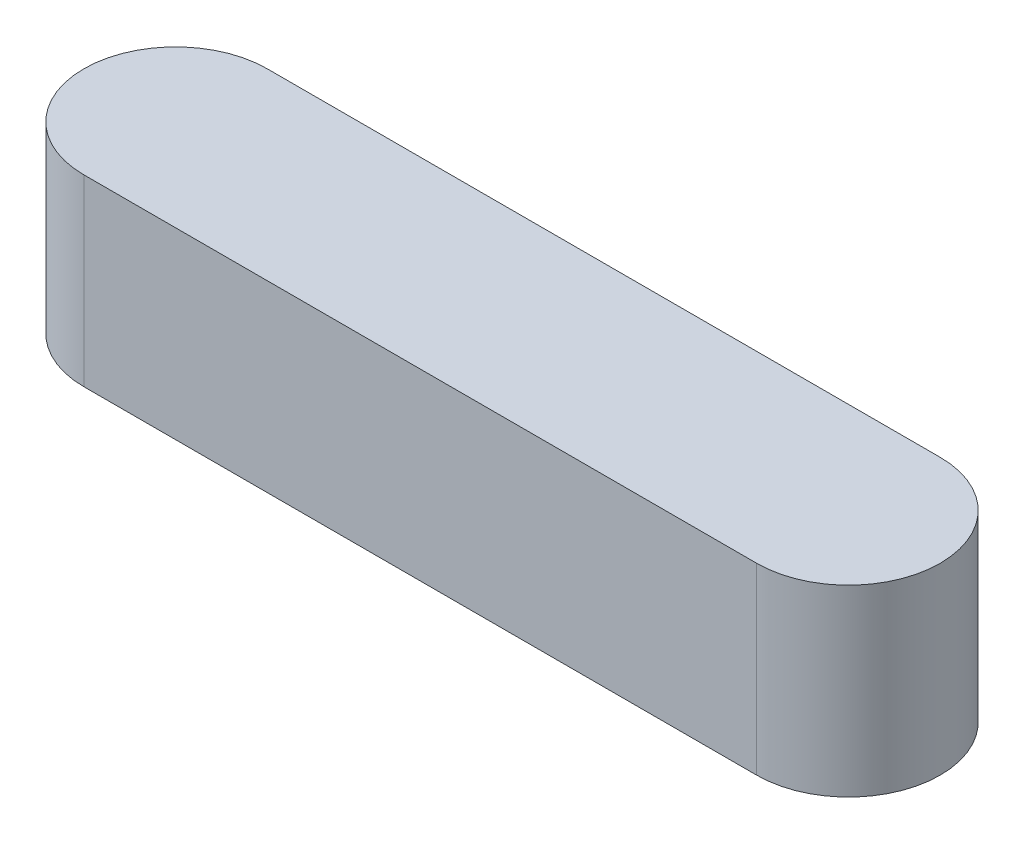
SolidWorks part; units mm, degrees
ref_plane "前视基准面" through (0, 0, 0) normal (0, 0, 1) x (1, 0, 0)
ref_plane "上视基准面" through (0, 0, 0) normal (0, 1, 0) x (1, 0, 0)
ref_plane "右视基准面" through (0, 0, 0) normal (1, 0, 0) x (0, 0, -1)
other "Configuration Table"
sketch "草图1" plane through (0, 0, 0) normal (0, 1, 0) x (1, 0, 0)
  line L0 (0, 0) -> (11, 0) construction
  line L1 (0, 1.5) -> (11, 1.5)
  line L2 (0, -1.5) -> (11, -1.5)
  arc A0 (0, 1.5) -> (0, -1.5) centre (0, 0) ccw
  arc A1 (11, -1.5) -> (11, 1.5) centre (11, 0) ccw
  point P3 (5.5, 0)
  dimension "D2" = 11
  dimension "D1" = 3
extrude "凸台-拉伸1" add sketch "草图1" along normal blind 3
